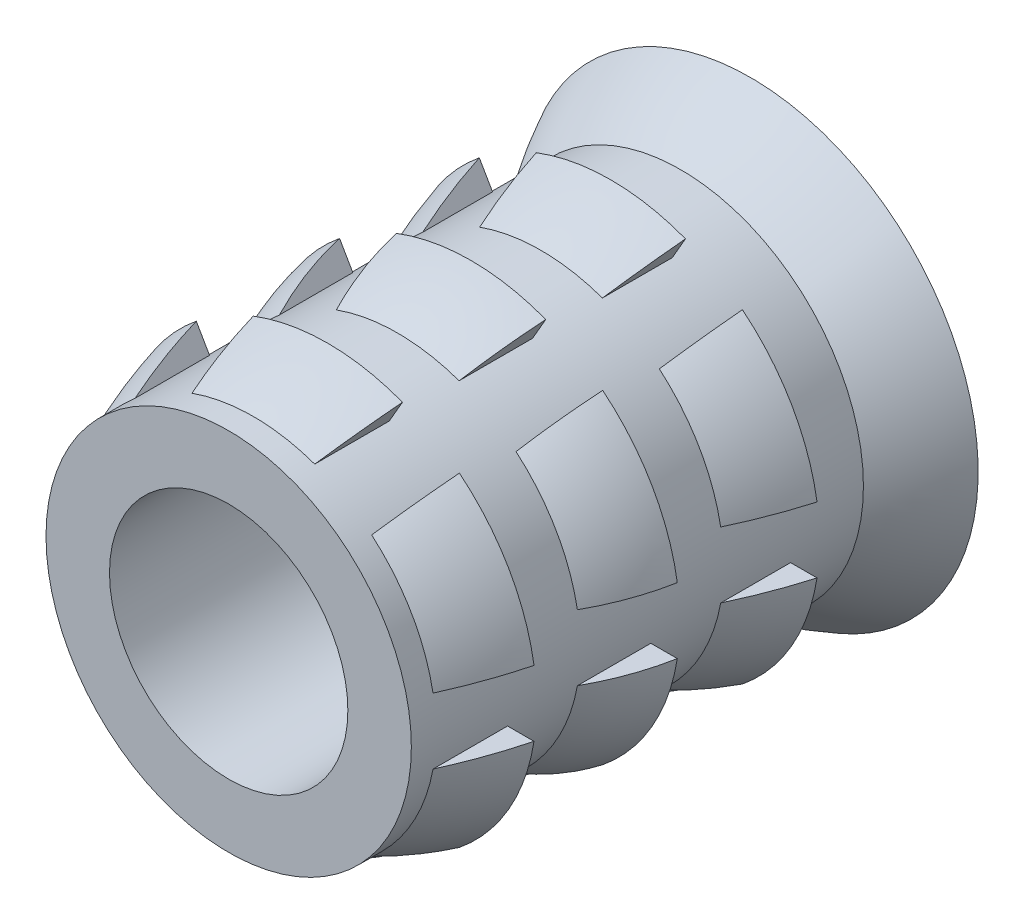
SolidWorks part; units mm, degrees
other "<insert M3.5>-<CirPattern1>"
ref_plane "Front" through (0, 0, 0) normal (0, 0, 1) x (1, 0, 0)
ref_plane "Top" through (0, 0, 0) normal (0, 1, 0) x (1, 0, 0)
ref_plane "Right" through (0, 0, 0) normal (1, 0, 0) x (0, 0, -1)
inserted part "insert M3.5"
move or copy body "Body-Move/Copy2"
